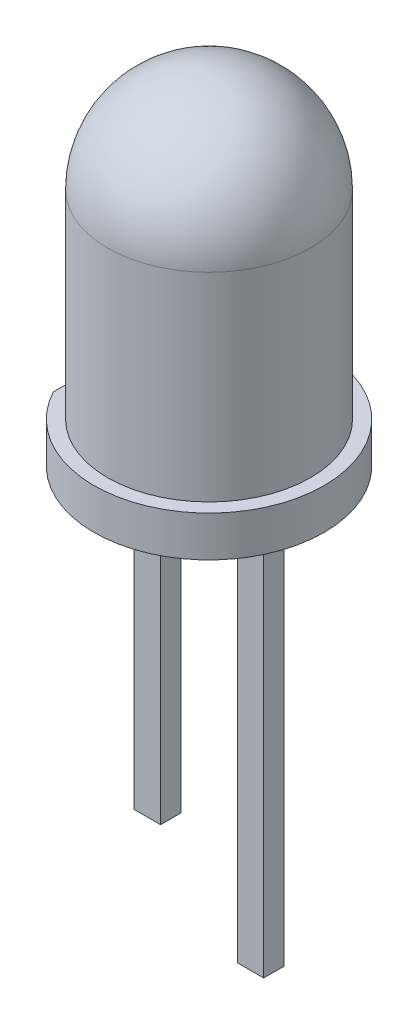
SolidWorks part; units mm, degrees
ref_plane "Plan de face" through (0, 0, 0) normal (0, 0, 1) x (1, 0, 0)
ref_plane "Plan de dessus" through (0, 0, 0) normal (0, 1, 0) x (1, 0, 0)
ref_plane "Plan de droite" through (0, 0, 0) normal (1, 0, 0) x (0, 0, -1)
sketch "Esquisse1" plane through (0, 0, 0) normal (0, 0, 1) x (1, 0, 0)
  line L0 (-2.5, 5.9) -> (-2.5, 1)
  line L1 (-2.5, 1) -> (-2.835, 1)
  line L2 (-2.835, 1) -> (-2.835, 0)
  line L3 (-2.835, 0) -> (0, 0)
  line L4 (0, 0) -> (0, 8.4)
  arc A0 (-2.5, 5.9) -> (0, 8.4) centre (0, 5.9) cw
  dimension "D5" = 8.4
  dimension "D6" = 2.5
  dimension "D1" = 2.835
  dimension "D2" = 1
  dimension "D3" = 0.335
revolve "Révolution1" add sketch "Esquisse1" angle 360 about L4
sketch "Esquisse2" plane through (0, 0, 0) normal (0, 0, 1) x (1, 0, 0)
  line L5 (-2.5, 1) -> (-3.7991, 1)
  line L6 (-2.5, 1) -> (-2.5, 0)
  line L7 (-2.5, 0) -> (-3.7991, 0)
  line L8 (-3.7991, 1) -> (-3.7991, 0)
extrude "Enlèv. mat.-Extru.1" cut sketch "Esquisse2" against normal mid plane 10
sketch "Esquisse3" plane through (0, 0, 0) normal (0, -1, 0) x (1, 0, 0)
  line L0 (-1.27, 0) -> (2.8977, 0) construction
  line L1 (0.945, 0.25) -> (1.595, 0.25)
  line L2 (0.945, 0.25) -> (0.945, -0.25)
  line L3 (0.945, -0.25) -> (1.595, -0.25)
  line L4 (1.595, 0.25) -> (1.595, -0.25)
  line L5 (1.27, 0) -> (1.27, -0.9015) construction
  line L6 (0, 0) -> (0, 1.697) construction
  line L7 (-1.595, 0.25) -> (-1.595, -0.25)
  line L8 (-0.945, -0.25) -> (-1.595, -0.25)
  line L9 (-0.945, 0.25) -> (-0.945, -0.25)
  line L10 (-0.945, 0.25) -> (-1.595, 0.25)
  circle A1 centre (0, 0) radius 1.27 construction
  dimension "D3" = 2.54
  dimension "D1" = 0.25
  dimension "D4" = 0.5
  dimension "D5" = 0.325
  dimension "D6" = 0.65
extrude "Extrusion1" add sketch "Esquisse3" along normal blind 10
ref_plane "Plan1" through (0, -1.6, 0) normal (0, -1, 0) x (1, 0, 0)
sketch "Esquisse5" plane through (0, 0, 0) normal (0, 0, 1) x (1, 0, 0)
  line L0 (0.945, 0) -> (0.945, 0.23)
  line L1 (0.945, 0.23) -> (0.2311, 0.3778)
  line L2 (0.2311, 0.3778) -> (-1.293, 3.5876)
  line L3 (-1.293, 3.5876) -> (-0.1037, 2.9816)
  line L4 (1.595, 0) -> (1.595, 3.5)
  line L5 (1.595, 3.5) -> (0.8063, 3.5)
  line L6 (0.8063, 3.5) -> (0.5215, 3.1248)
  line L8 (1.595, 0) -> (0.945, 0)
  line L9 (-1.595, 0) -> (-1.595, 3.2933)
  line L10 (-0.945, -10) -> (-0.945, 0) construction
  line L11 (-1.595, 3.2933) -> (-0.324, 0.6165)
  line L12 (-1.595, 0) -> (-0.945, 0)
  line L13 (-0.945, 0) -> (-0.945, 0.2717)
  line L14 (-0.945, 0.2717) -> (-0.324, 0.6165)
  line L15 (-2.5, 0) -> (2.835, 0) construction
  arc A0 (-0.1037, 2.9816) -> (0.5215, 3.1248) centre (0.1233, 3.4271) ccw
  dimension "D8" = 0.5
  dimension "D1" = 3.5
  dimension "D2" = 0.23
  dimension "D3" = 11.7
  dimension "D4" = 25.4
  dimension "D6" = 63
  dimension "D7" = 37.2
extrude "Extrusion3" add sketch "Esquisse5" along normal mid plane 0.5 separate body
sketch "Esquisse6" plane through (0, 0, 0.25) normal (0, 0, 1) x (1, 0, 0)
  line L1 (-0.945, -10) -> (-2.9524, -10)
  line L2 (-0.945, -10) -> (-0.945, -8)
  line L3 (-0.945, -8) -> (-2.9524, -8)
  line L4 (-2.9524, -10) -> (-2.9524, -8)
  dimension "D1" = 2
extrude "Enlèv. mat.-Extru.2" cut sketch "Esquisse6" against normal through all
